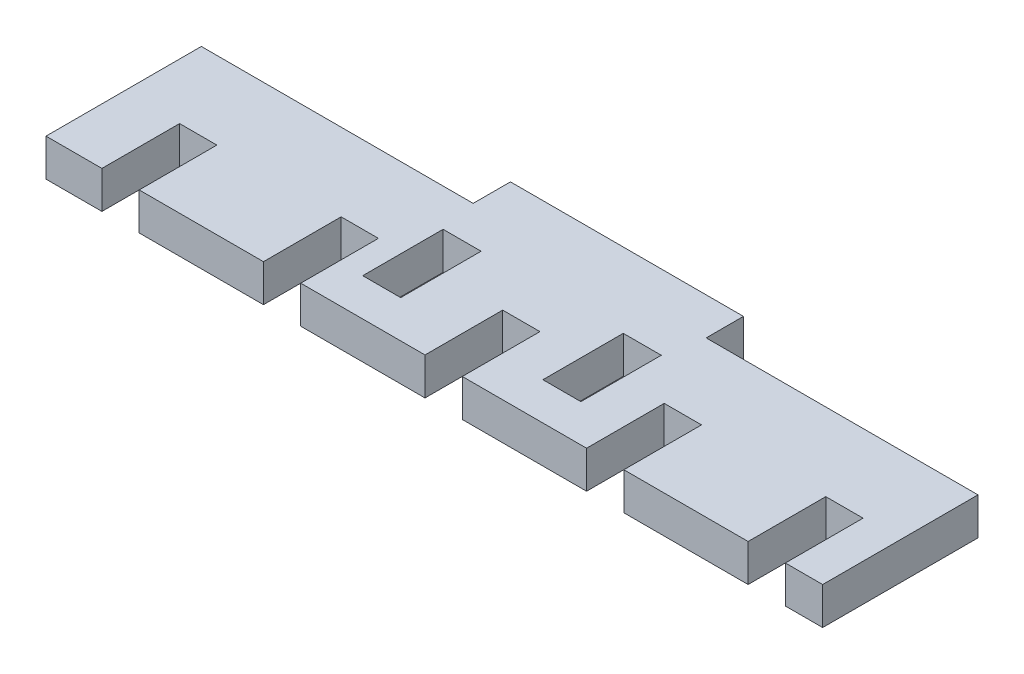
SolidWorks part; units mm, degrees
ref_plane "Front Plane" through (0, 0, 0) normal (0, 0, 1) x (1, 0, 0)
ref_plane "Top Plane" through (0, 0, 0) normal (0, 1, 0) x (1, 0, 0)
ref_plane "Right Plane" through (0, 0, 0) normal (1, 0, 0) x (0, 0, -1)
sketch "Sketch1" plane through (0, 0, 0) normal (0, 1, 0) x (1, 0, 0)
  line L0 (19.1135, -3.175) -> (19.1135, -6.35)
  line L1 (20.6375, 0) -> (9.525, 0)
  line L2 (0, 0) -> (0, 1.524)
  line L3 (0, 1.524) -> (9.525, 1.524)
  line L4 (9.525, 0) -> (9.525, 1.524)
  line L5 (-11.1125, 0) -> (-11.1125, -6.35)
  line L6 (20.6375, 0) -> (20.6375, -6.35)
  line L7 (-11.1125, -6.35) -> (-8.8265, -6.35)
  line L8 (0, 0) -> (-11.1125, 0)
  line L9 (19.1135, -3.175) -> (17.5895, -3.175)
  line L10 (17.5895, -3.175) -> (17.5895, -6.35)
  line L11 (19.1135, 0) -> (19.1135, -6.35) construction
  line L12 (19.1135, -6.35) -> (20.6375, -6.35)
  line L13 (12.5095, -3.175) -> (12.5095, -6.35)
  line L14 (12.5095, -3.175) -> (10.9855, -3.175)
  line L15 (10.9855, -3.175) -> (10.9855, -6.35)
  line L16 (5.9055, -3.175) -> (5.9055, -6.35)
  line L17 (5.9055, -3.175) -> (4.3815, -3.175)
  line L18 (4.3815, -3.175) -> (4.3815, -6.35)
  line L19 (-0.6985, -3.175) -> (-0.6985, -6.35)
  line L20 (-0.6985, -3.175) -> (-2.2225, -3.175)
  line L21 (-2.2225, -3.175) -> (-2.2225, -6.35)
  line L22 (-7.3025, -3.175) -> (-7.3025, -6.35)
  line L23 (-7.3025, -3.175) -> (-8.8265, -3.175)
  line L24 (-8.8265, -3.175) -> (-8.8265, -6.35)
  line L25 (-7.3025, -6.35) -> (-2.2225, -6.35)
  line L26 (-0.6985, -6.35) -> (4.3815, -6.35)
  line L27 (5.9055, -6.35) -> (10.9855, -6.35)
  line L28 (12.5095, -6.35) -> (17.5895, -6.35)
  line L29 (4.7625, 1.524) -> (4.7625, 5.7905) construction
  line L30 (9.2223, -1.5323) -> (7.6687, -1.5323)
  line L31 (9.2223, -1.5323) -> (9.2223, -4.8177)
  line L32 (9.2223, -4.8177) -> (7.6687, -4.8177)
  line L33 (7.6687, -1.5323) -> (7.6687, -4.8177)
  line L34 (9.2223, -1.5323) -> (7.6687, -4.8177) construction
  line L35 (9.2223, -4.8177) -> (7.6687, -1.5323) construction
  line L36 (0.3027, -4.8177) -> (1.8563, -1.5323) construction
  line L37 (0.3027, -1.5323) -> (1.8563, -4.8177) construction
  line L38 (1.8563, -1.5323) -> (1.8563, -4.8177)
  line L39 (0.3027, -4.8177) -> (1.8563, -4.8177)
  line L40 (0.3027, -1.5323) -> (0.3027, -4.8177)
  line L41 (0.3027, -1.5323) -> (1.8563, -1.5323)
  point P14 (8.4455, -3.175)
  point P41 (1.0795, -3.175)
  dimension "D1" = 9.525
  dimension "D2" = 1.524
  dimension "D3" = 1.524
  dimension "D4" = 5
extrude "Boss-Extrude1" add sketch "Sketch1" along normal blind 1.524
